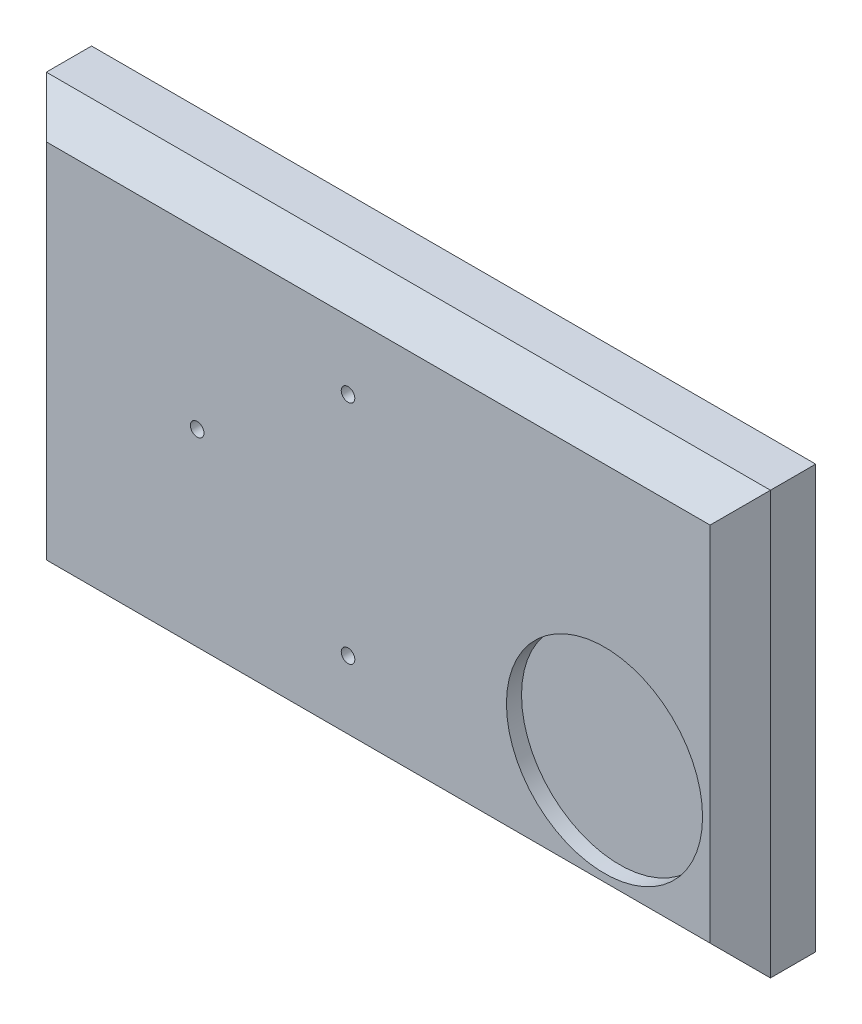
SolidWorks part; units mm, degrees
ref_plane "Front" through (0, 0, 0) normal (0, 0, 1) x (1, 0, 0)
ref_plane "Top" through (0, 0, 0) normal (0, 1, 0) x (1, 0, 0)
ref_plane "Right" through (0, 0, 0) normal (1, 0, 0) x (0, 0, -1)
sketch "Esquisse1" plane through (0, 0, 0) normal (0, 0, 1) x (1, 0, 0)
  line L1 (-120, 70) -> (120, 70)
  line L2 (-120, 70) -> (-120, -70)
  line L3 (-120, -70) -> (120, -70)
  line L4 (120, 70) -> (120, -70)
  line L5 (-120, 70) -> (120, -70) construction
  line L6 (-120, -70) -> (120, 70) construction
  point P0 (0, 0)
  dimension "D1" = 140
  dimension "D2" = 240
extrude "Boss.-Extru.1" add sketch "Esquisse1" along normal blind 25
hole_wizard "Chambrage pour vis à tête cylindrique à 6 pans creux (ou vis CHC) M41" positions "Esquisse3" profile "Esquisse2" counterbore size "M4" standard "Ansi Metric"
sketch "Esquisse3" plane through (0, 0, 0) normal (0, 0, -1) x (-1, 0, 0)
  line L3 (120, -70) -> (-120, -70) construction
  line L4 (120, 70) -> (120, -70) construction
  point P2 (10, 37.5)
  point P4 (10, -37.5)
  point P23 (60, 2.5)
  dimension "D1" = 32.5
  dimension "D2" = 35
  dimension "D3" = 60
  dimension "D4" = 75
  dimension "D5" = 50
  dimension "D6" = 0
sketch "Esquisse2" plane through (-10, 37.5, 0) normal (1, 0, 0) x (0, 1, 0)
  line L0 (0, 0) -> (0, 25)
  line L1 (0, 25) -> (2.25, 25)
  line L3 (2.25, 25) -> (2.25, 4)
  line L4 (2.25, 4) -> (4, 4)
  line L5 (4, 4) -> (4, 0)
  line L7 (4, 0) -> (0, 0)
  line L11 (0, -6.35) -> (0, 107.95) construction
  dimension "Diamètre du perçage jusqu'au prochain" = 4.5
  dimension "Profondeur du perçage jusqu'au prochain" = 25
  dimension "Diamètre du chambrage" = 8
  dimension "Profondeur du chambrage" = 4
chamfer "Chanfrein1" distance 10 angle 45 4 edges at (120, 0, 25) (0, -70, 25) (-120, 0, 25) (0, 70, 25)
sketch "Esquisse4" plane through (0, 0, 25) normal (0, 0, 1) x (1, 0, 0)
  line L0 (-120, -70) -> (120, -70) construction
  line L1 (120, -70) -> (120, 70) construction
  circle A0 centre (75, -25) radius 32.5
  dimension "D1" = 65
  dimension "D2" = 45
  dimension "D3" = 45
extrude "Enlèv. mat.-Extru.1" cut sketch "Esquisse4" against normal blind 5 contours A0
